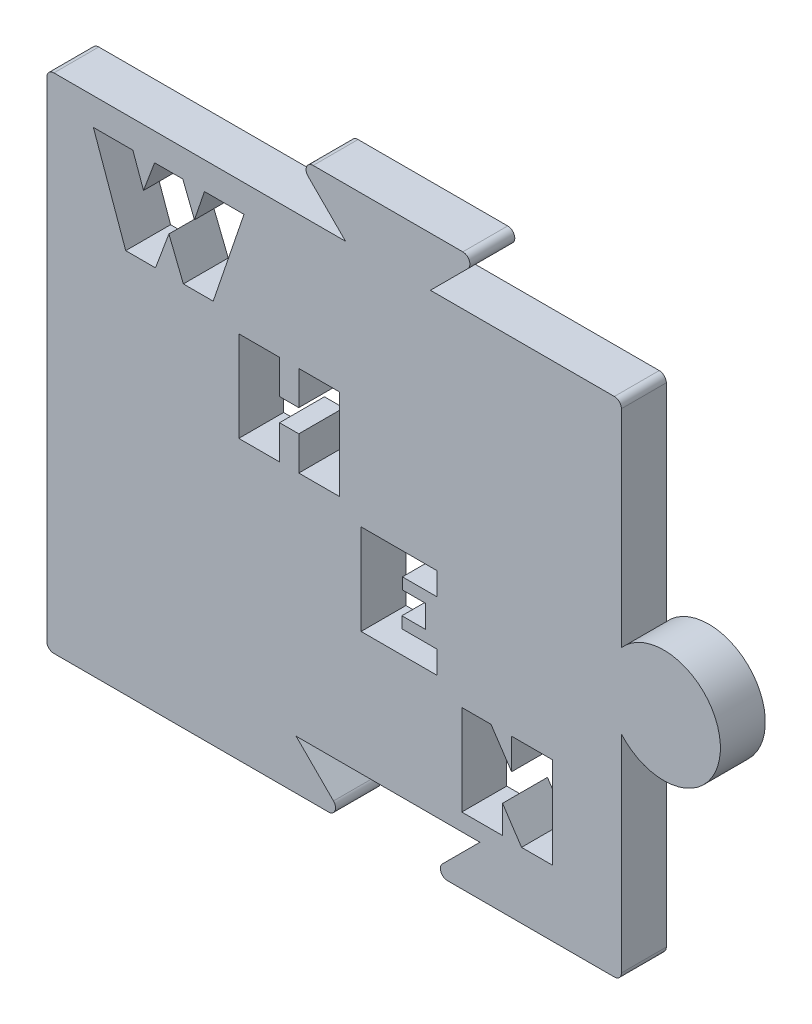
SolidWorks part; units mm, degrees
ref_plane "Front" through (0, 0, 0) normal (0, 0, 1) x (1, 0, 0)
ref_plane "Top" through (0, 0, 0) normal (0, 1, 0) x (1, 0, 0)
ref_plane "Right" through (0, 0, 0) normal (1, 0, 0) x (0, 0, -1)
sketch "Sketch1" plane through (0, 0, 0) normal (0, 0, 1) x (1, 0, 0)
  line L0 (0, 0) -> (0, 35.56) construction
  line L1 (40.64, 35.56) -> (40.64, 20.4258)
  line L2 (40.64, 0) -> (0, 0) construction
  line L3 (0, 35.56) -> (40.64, 35.56) construction
  line L4 (0, 17.78) -> (40.64, 17.78) construction
  line L5 (24.13, 35.56) -> (24.13, 0) construction
  line L6 (0, 35.56) -> (21.13, 35.56)
  line L7 (17.63, 39.06) -> (21.13, 35.56)
  line L8 (17.63, 39.06) -> (30.63, 39.06)
  line L9 (27.13, 35.56) -> (30.63, 39.06)
  line L10 (40.64, 35.56) -> (27.13, 35.56)
  line L11 (0, 0) -> (21.13, 0)
  line L12 (17.63, 3.5) -> (21.13, 0)
  line L13 (27.13, 0) -> (30.63, 3.5)
  line L14 (30.63, 3.5) -> (17.63, 3.5)
  line L15 (40.64, 0) -> (27.13, 0)
  line L16 (0, 35.56) -> (0, 0)
  line L21 (40.64, 15.1342) -> (40.64, 0)
  arc A0 (40.64, 15.1342) -> (40.64, 20.4258) centre (43.64, 17.78) ccw
  point P13 (24.13, 39.06)
  point P16 (24.13, 3.5)
  point P25 (43.64, 17.78)
  dimension "D13" = 8
  dimension "D2" = 3
  dimension "D3" = 24.13
  dimension "D4" = 3.5
  dimension "D5" = 45
  dimension "D6" = 3
  dimension "D7" = 3.5
  dimension "D8" = 45
  dimension "D9" = 40.64
  dimension "D10" = 35.56
  dimension "D12" = 3
extrude "Boss-Extrude1" add sketch "Sketch1" along normal blind 3.175
sketch "Sketch2" plane through (0, 0, 3.175) normal (0, 0, 1) x (1, 0, 0)
  line L1 (7.965, 3.6781) -> (44.033, 3.6781)
  line L2 (7.965, 3.6781) -> (7.965, 29.0781)
  line L3 (7.965, 29.0781) -> (44.033, 29.0781)
  line L4 (44.033, 3.6781) -> (44.033, 29.0781)
  dimension "D1" = 25.4
  dimension "D2" = 36.068
extrude "Cut-Extrude1" [suppressed] cut sketch "Sketch2" against normal blind 1
sketch "Sketch3" [suppressed] plane through (0, 0, 9) normal (0, 0, 1) x (1, 0, 0)
  line L0 (7.965, 3.6781) -> (44.033, 3.6781) construction
  line L1 (44.033, 29.0781) -> (18.633, 29.0781)
  line L2 (44.033, 29.0781) -> (44.033, 3.6781)
  line L3 (44.033, 3.6781) -> (18.633, 3.6781)
  line L4 (18.633, 29.0781) -> (18.633, 3.6781)
extrude "Cut-Extrude2" [suppressed] cut sketch "Sketch3" against normal blind 1
sketch "Sketch4" plane through (0, 0, 3.175) normal (0, 0, 1) x (1, 0, 0)
  text T0 "W" font "Gill Sans Ultra Bold" height in points 24
  text T1 "H" font "Gill Sans Ultra Bold" height in points 24
  text T2 "E" font "Gill Sans Ultra Bold" height in points 24
  text T3 "N" font "Gill Sans Ultra Bold" height in points 24
  dimension "D1" = 7.5
  dimension "D2" = 7.5
  dimension "D3" = 7.5
extrude "Cut-Extrude3" cut sketch "Sketch4" against normal through all
fillet "Fillet1" radius 0.5 8 edges at (40.64, 35.56, 1.5875) (40.64, 0, 1.5875) (0, 35.56, 1.5875) (30.63, 39.06, 1.5875) (17.63, 39.06, 1.5875) (27.13, 0, 1.5875) (21.13, 0, 1.5875) (0, 0, 1.5875)
